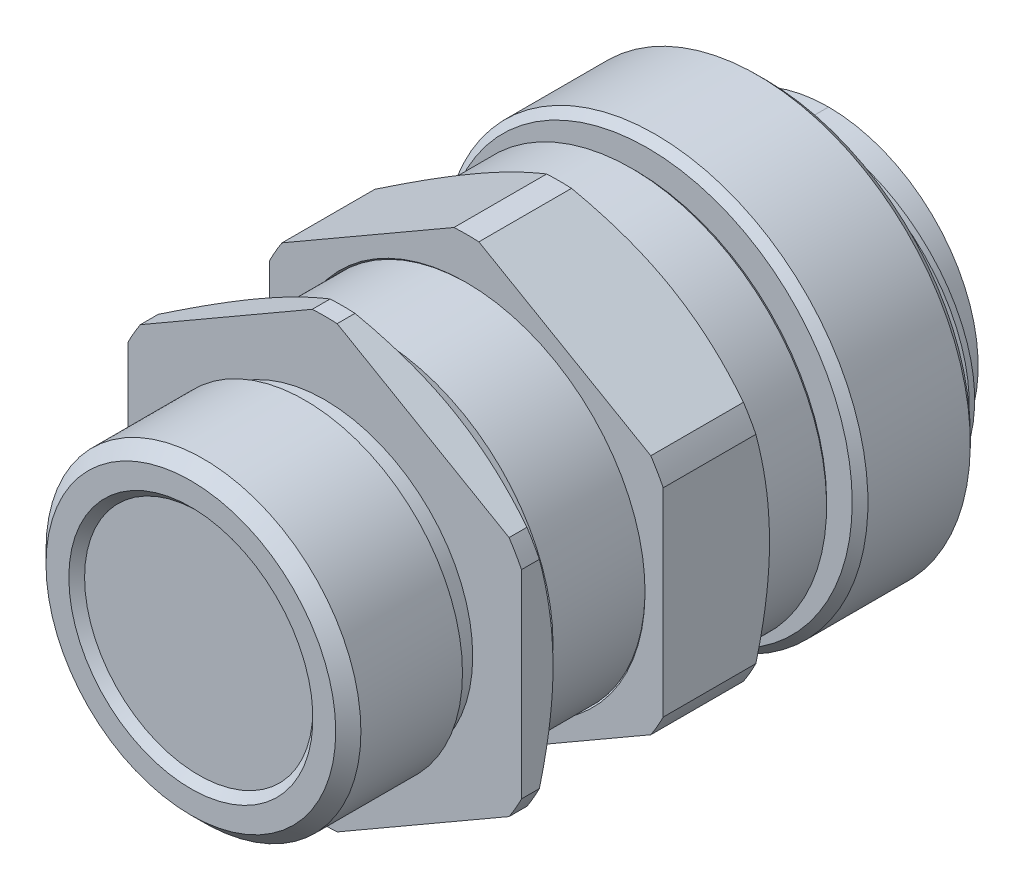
SolidWorks part; units mm, degrees
ref_plane "Спереди" through (0, 0, 0) normal (0, 0, 1) x (1, 0, 0)
ref_plane "Сверху" through (0, 0, 0) normal (0, 1, 0) x (1, 0, 0)
ref_plane "Справа" through (0, 0, 0) normal (1, 0, 0) x (0, 0, -1)
imported_body "FETG4I-32_38B-Корпус кабельного ввода-2-solid1"
imported_body "FETG4_B-ВТУЛКА-1-solid1"
imported_body "FEC4_B-Гайка-1-solid1"
imported_body "FETG4_38B-Штуцер МР-1-solid1"
imported_body "FETG4_B-Кольцо стопорное-1-solid1"
imported_body "FETG4_38B-Колпачок-1-solid1"
other "Переместить грань1" parameters "D1"=3
other "Переместить грань2" parameters "D1"=1
other "Переместить грань3" parameters "D1"=3
other "Переместить грань4" parameters "D1"=3
other "Переместить грань5" parameters "D1"=4
combine bodies "Соединить1" operation type add bodies to combine 106 104 110 111 105 107
other "Удалить грань1"
surface "Поверхность-Заполнить1"
surface "Поверхность-Заполнить2"
